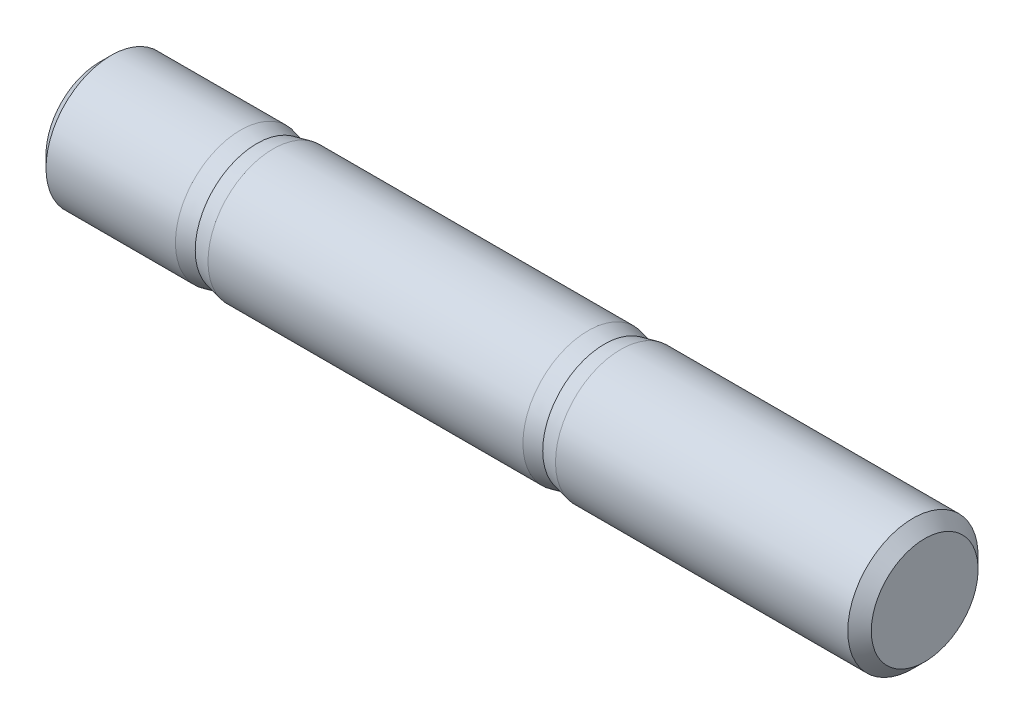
SolidWorks part; units mm, degrees
ref_plane "Front" through (0, 0, 0) normal (0, 0, 1) x (1, 0, 0)
ref_plane "Top" through (0, 0, 0) normal (0, 1, 0) x (1, 0, 0)
ref_plane "Right" through (0, 0, 0) normal (1, 0, 0) x (0, 0, -1)
other "Configuration Table"
sketch "Sketch1" plane through (0, 0, 0) normal (0, 0, 1) x (1, 0, 0)
  line L0 (-1.3108, 0) -> (30.3862, 0) construction
  line L1 (0, 0) -> (0, 3)
  line L2 (0, 3) -> (6.5, 3)
  line L3 (6.5, 3) -> (8, 2.675)
  line L4 (8, 2.675) -> (22.5, 2.675)
  line L5 (22.5, 2.675) -> (24, 3)
  line L6 (24, 3) -> (38, 3)
  line L7 (38, 3) -> (38, 0)
  line L8 (38, 0) -> (0, 0)
revolve "BaseHead" add sketch "Sketch1" angle 360 about L0
chamfer "HeadChamfer" distance 0.5415 angle 45 2 edges at (0, 0, 3) (38, 0, 3)
sketch "Sketch2" plane through (0, 0, 0) normal (0, 0, 1) x (1, 0, 0)
  line L0 (-1.3108, 0) -> (31.2107, 0) construction
  line L1 (24, 3) -> (24, -3) construction
  line L2 (6.5, 2.675) -> (8, 3)
  line L3 (8, 3) -> (22.5, 3)
  line L4 (22.5, 3) -> (24, 2.675)
  line L5 (6.5, 3) -> (6.5, -3) construction
  line L9 (6.5, 2.675) -> (24, 2.675)
revolve "BaseBody" add sketch "Sketch2" angle 360 about L0
sketch "Sketch3" plane through (0, 0, 0) normal (0, 0, 1) x (1, 0, 0)
  line L0 (37.4585, 2.531) -> (37.7292, 3)
  line L1 (37.7292, 3) -> (37.7292, 3.5)
  line L2 (37.7292, 3.5) -> (37.1877, 3.5)
  line L3 (37.1877, 3.5) -> (37.1877, 3)
  line L4 (37.1877, 3) -> (37.4585, 2.531)
  line L5 (0, 0) -> (46.2373, 0) construction
  line L6 (37.4585, 3) -> (37.4585, -3) construction
revolve "Cut-Revolve10" [suppressed] cut sketch "Sketch3" angle 360 about L5
pattern_linear "LPattern10" [suppressed] count 22 spacing 0.6498 along (1, 0, 0)
sketch "Sketch4" plane through (0, 0, 0) normal (0, 0, 1) x (1, 0, 0)
  line L0 (0.5415, 2.531) -> (0.8123, 3)
  line L1 (0.8123, 3) -> (0.8123, 3.5)
  line L2 (0.8123, 3.5) -> (0.2708, 3.5)
  line L3 (0.2708, 3.5) -> (0.2708, 3)
  line L4 (0.2708, 3) -> (0.5415, 2.531)
  line L5 (0, 0) -> (8.4336, 0) construction
  line L6 (0, 2.4585) -> (0, -2.4585) construction
  line L7 (0.5415, 3) -> (0.5415, -3) construction
revolve "Cut-Revolve11" [suppressed] cut sketch "Sketch4" angle 360 about L5
pattern_linear "LPattern11" [suppressed] count 10 spacing 0.6498 along (1, 0, 0)
equation "\"D2@Sketch1\" = \"X@Sketch1\""
equation "\"D2@ThreadCosmetic2\" = \"D2@ThreadCosmetic1\""
equation "\"D1@ThreadCosmetic1\" = \"bm@Sketch1\"-\"X@Sketch1\""
equation "\"b@ThreadCosmetic2\" = \"b@Sketch1\""
equation "\"D1@Sketch2\" = \"X@Sketch1\""
equation "\"D2@Sketch2\" = \"d@Sketch1\""
equation "\"D1@HeadChamfer\" =  ( \"d@Sketch1\" - \"D2@ThreadCosmetic1\" )  / 2"
equation "\"D5@Sketch3\" = \"d@Sketch1\""
equation "\"D4@Sketch3\" =  ( \"d@Sketch1\" - \"D2@ThreadCosmetic2\" )  / 2"
equation "\"D3@LPattern10\" = \"D4@Sketch3\" * 1.2"
equation "\"D1@LPattern10\" = \"b@ThreadCosmetic2\" / \"D3@LPattern10\""
equation "\"D5@Sketch4\" = \"d@Sketch1\""
equation "\"D4@Sketch4\" =  ( \"d@Sketch1\" - \"D2@ThreadCosmetic1\" )  / 2"
equation "\"D3@LPattern11\" = \"D4@Sketch4\" * 1.2"
equation "\"D1@LPattern11\" = \"D1@ThreadCosmetic1\" / \"D3@LPattern11\""
